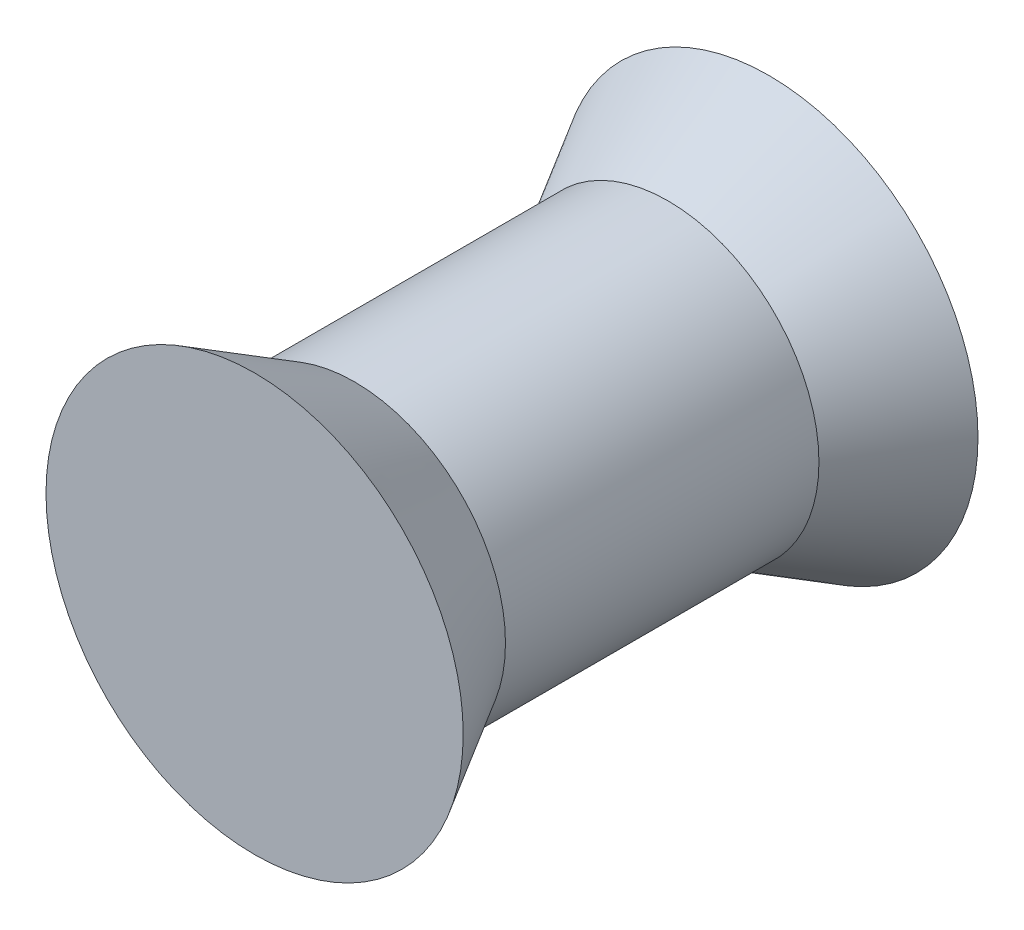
SolidWorks part; units mm, degrees
ref_plane "Спереди" through (0, 0, 0) normal (0, 0, 1) x (1, 0, 0)
ref_plane "Сверху" through (0, 0, 0) normal (0, 1, 0) x (1, 0, 0)
ref_plane "Справа" through (0, 0, 0) normal (1, 0, 0) x (0, 0, -1)
sketch "Эскиз1" plane through (0, 0, 0) normal (1, 0, 0) x (0, 0, -1)
  line L0 (0, 0) -> (33.6834, 0) construction
  line L1 (8.0975, 3.2914) -> (6.51, 2.3749)
  line L2 (6.51, 2.3749) -> (1.5748, 2.3749)
  line L3 (1.5748, 2.3749) -> (0, 3.2841)
  line L4 (0, 3.2841) -> (0, 0)
  line L5 (0, 0) -> (9.0172, 0)
  arc A0 (9.0172, 0) -> (8.0975, 3.2914) centre (2.6672, 0) ccw
  dimension "D5" = 6.35
  dimension "D1" = 8.0975
  dimension "D2" = 4.7498
  dimension "D3" = 30
  dimension "D4" = 30
  dimension "D6" = 1.5875
  dimension "D7" = 1.5748
revolve "Повернуть1" add sketch "Эскиз1" angle 360 about L0
